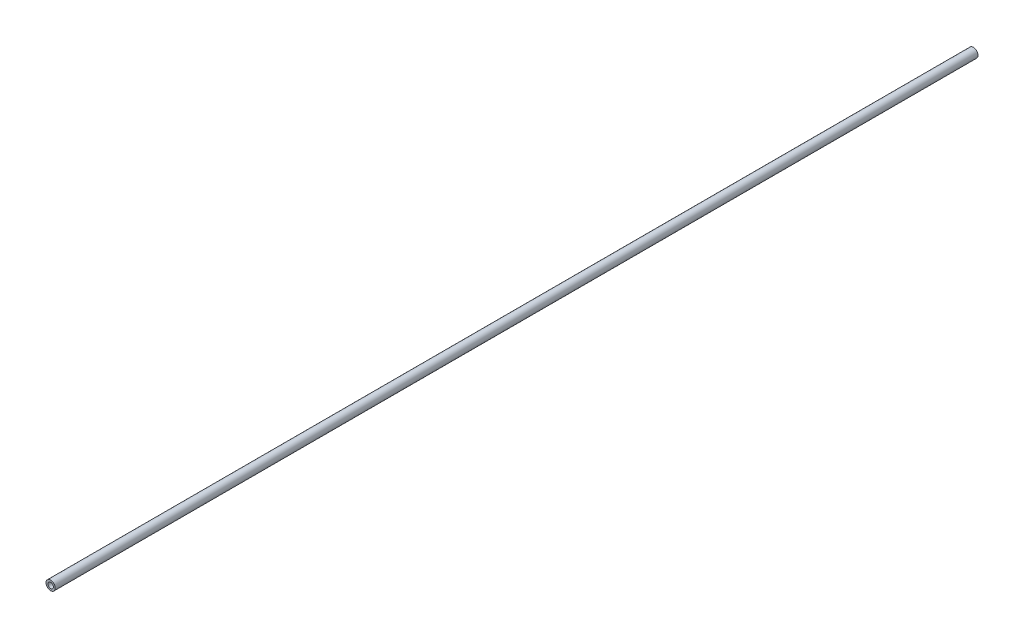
SolidWorks part; units mm, degrees
ref_plane "Front Plane" through (0, 0, 0) normal (0, 0, 1) x (1, 0, 0)
ref_plane "Top Plane" through (0, 0, 0) normal (0, 1, 0) x (1, 0, 0)
ref_plane "Right Plane" through (0, 0, 0) normal (1, 0, 0) x (0, 0, -1)
sketch "Sketch1" plane through (0, 0, 0) normal (1, 0, 0) x (0, 0, -1)
  line L0 (0, 0) -> (-2000, 0)
sketch "Sketch2" plane through (0, 0, 0) normal (0, 0, 1) x (1, 0, 0)
  circle A0 centre (0, 0) radius 10
  dimension "D1" = 20
sweep "Sweep-Thin1" add profiles "Sketch2" path "Sketch1" parameters "D1"=4
